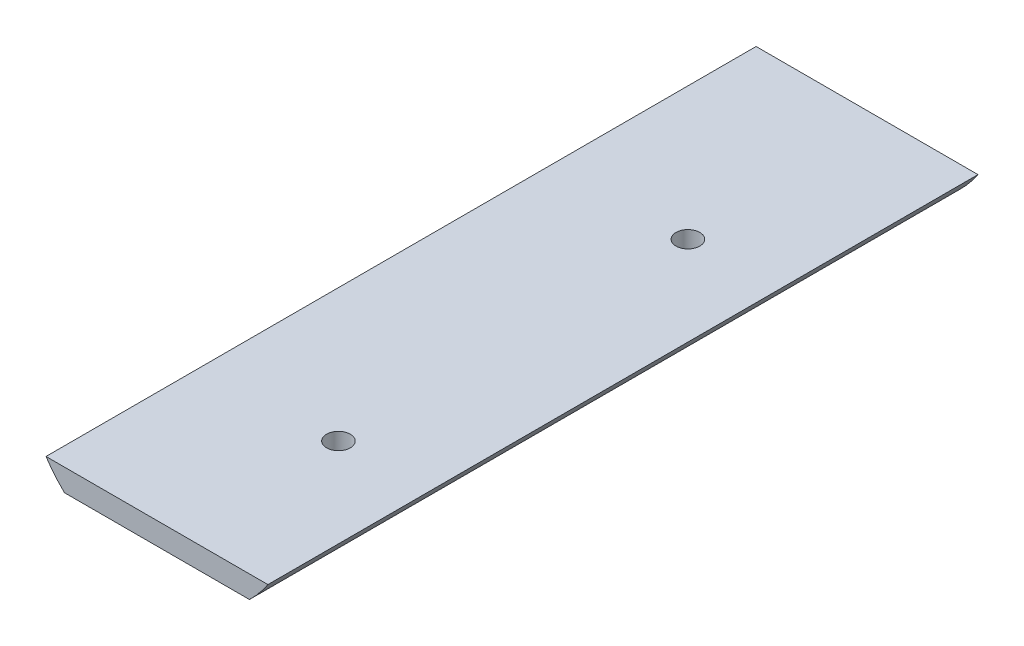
SolidWorks part; units mm, degrees
ref_plane "Front Plane" through (0, 0, 0) normal (0, 0, 1) x (1, 0, 0)
ref_plane "Top Plane" through (0, 0, 0) normal (0, 1, 0) x (1, 0, 0)
ref_plane "Right Plane" through (0, 0, 0) normal (1, 0, 0) x (0, 0, -1)
inserted part "Part 1<9>@Assem1"
